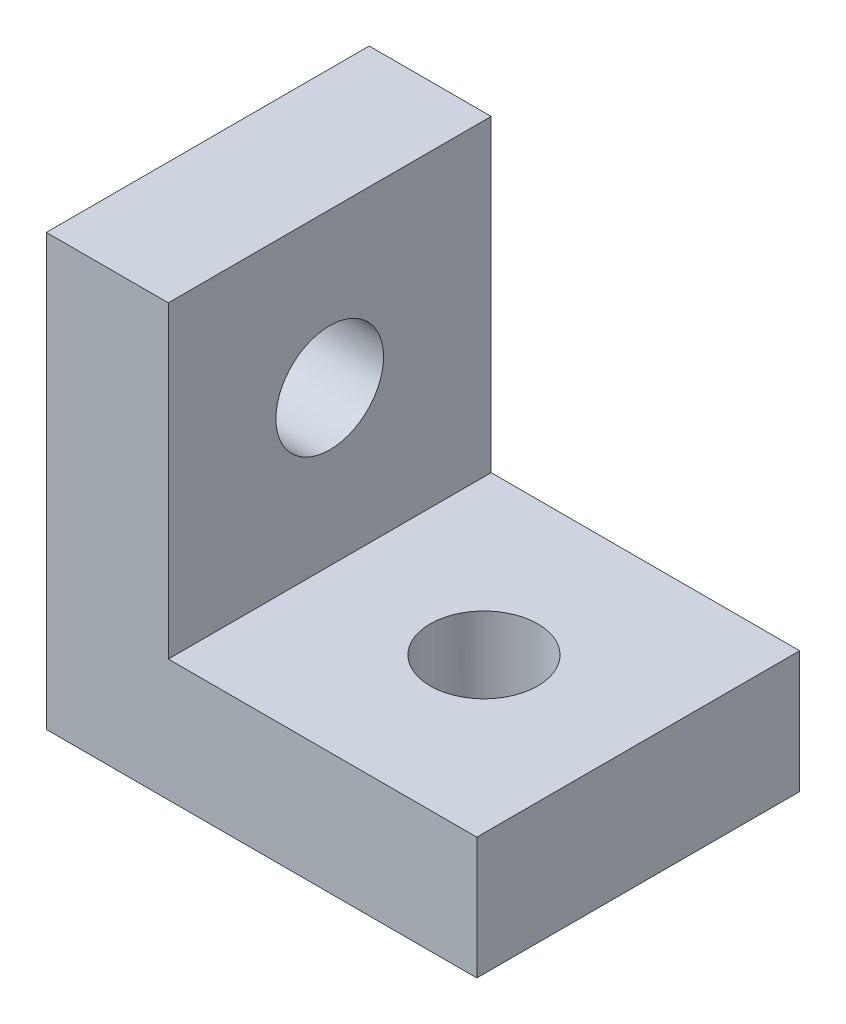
SolidWorks part; units mm, degrees
ref_plane "Front" through (0, 0, 0) normal (0, 0, 1) x (1, 0, 0)
ref_plane "Top" through (0, 0, 0) normal (0, 1, 0) x (1, 0, 0)
ref_plane "Right" through (0, 0, 0) normal (1, 0, 0) x (0, 0, -1)
sketch "Sketch1" plane through (0, 0, 0) normal (0, 0, 1) x (1, 0, 0)
sketch "Sketch3" plane through (0, 0, 0) normal (0, 0, 1) x (1, 0, 0)
  line L0 (31.75, 15.875) -> (107.95, 15.875)
  line L1 (107.95, 15.875) -> (107.95, 37.465)
  line L2 (107.95, 37.465) -> (53.34, 37.465)
  line L3 (53.34, 37.465) -> (53.34, 92.075)
  line L4 (53.34, 92.075) -> (31.75, 92.075)
  line L5 (31.75, 92.075) -> (31.75, 15.875)
  line L6 (71.12, 37.465) -> (71.12, 15.875) construction
  line L7 (90.17, 15.875) -> (90.17, 37.465) construction
  line L8 (53.34, 74.295) -> (31.75, 74.295) construction
  line L9 (31.75, 55.245) -> (53.34, 55.245) construction
sketch "Sketch4" plane through (0, 112.7125, 0) normal (0, 1, 0) x (-1, 0, 0)
  line L0 (-53.34, -77.7875) -> (-31.75, -77.7875)
  line L1 (-53.34, -77.7875) -> (-53.34, -20.6375)
  line L2 (-53.34, -20.6375) -> (-31.75, -20.6375)
  line L3 (-31.75, -77.7875) -> (-31.75, -20.6375)
  line L4 (-107.95, -77.7875) -> (-107.95, -20.6375)
  line L5 (-107.95, -20.6375) -> (-53.34, -20.6375)
  line L6 (-107.95, -77.7875) -> (-53.34, -77.7875)
  line L7 (-53.34, -58.7375) -> (-31.75, -58.7375) construction
  line L8 (-31.75, -39.6875) -> (-53.34, -39.6875) construction
  circle A0 centre (-80.645, -49.2125) radius 9.525
sketch "Sketch5" plane through (144.4625, 0, 0) normal (1, 0, 0) x (0, 0, -1)
  line L0 (77.7875, 37.465) -> (20.6375, 37.465)
  line L1 (20.6375, 15.875) -> (20.6375, 37.465)
  line L2 (77.7875, 15.875) -> (77.7875, 37.465)
  line L3 (77.7875, 15.875) -> (20.6375, 15.875)
  line L4 (77.7875, 92.075) -> (20.6375, 92.075)
  line L5 (20.6375, 37.465) -> (20.6375, 92.075)
  line L6 (77.7875, 37.465) -> (77.7875, 92.075)
  line L7 (39.6875, 37.465) -> (39.6875, 15.875) construction
  line L8 (58.7375, 15.875) -> (58.7375, 37.465) construction
  circle A0 centre (49.2125, 64.77) radius 9.525
sketch "Sketch6" plane through (31.75, 112.7125, -77.7875) normal (0, 0, 1) x (1, 0, 0)
  line L0 (0, -96.8375) -> (76.2, -96.8375)
  line L1 (76.2, -96.8375) -> (76.2, -75.2475)
  line L2 (76.2, -75.2475) -> (21.59, -75.2475)
  line L3 (21.59, -75.2475) -> (21.59, -20.6375)
  line L4 (21.59, -20.6375) -> (0, -20.6375)
  line L5 (0, -20.6375) -> (0, -96.8375)
extrude "Extrude1" add sketch "Sketch6" along normal up to vertex (57.15 mm away)
sketch "Sketch7" plane through (0, 112.7125, 0) normal (0, 1, 0) x (-1, 0, 0)
  circle A0 centre (-80.645, -49.2125) radius 9.525
sketch "Sketch9" plane through (0, 112.7125, 0) normal (0, 1, 0) x (-1, 0, 0)
  circle A0 centre (-80.645, -49.2125) radius 9.525
extrude "Cut-Extrude3" cut sketch "Sketch9" against normal through all
sketch "Sketch10" plane through (144.4625, 0, 0) normal (1, 0, 0) x (0, 0, -1)
  circle A0 centre (49.2125, 64.77) radius 9.525
extrude "Cut-Extrude4" cut sketch "Sketch10" against normal through all
